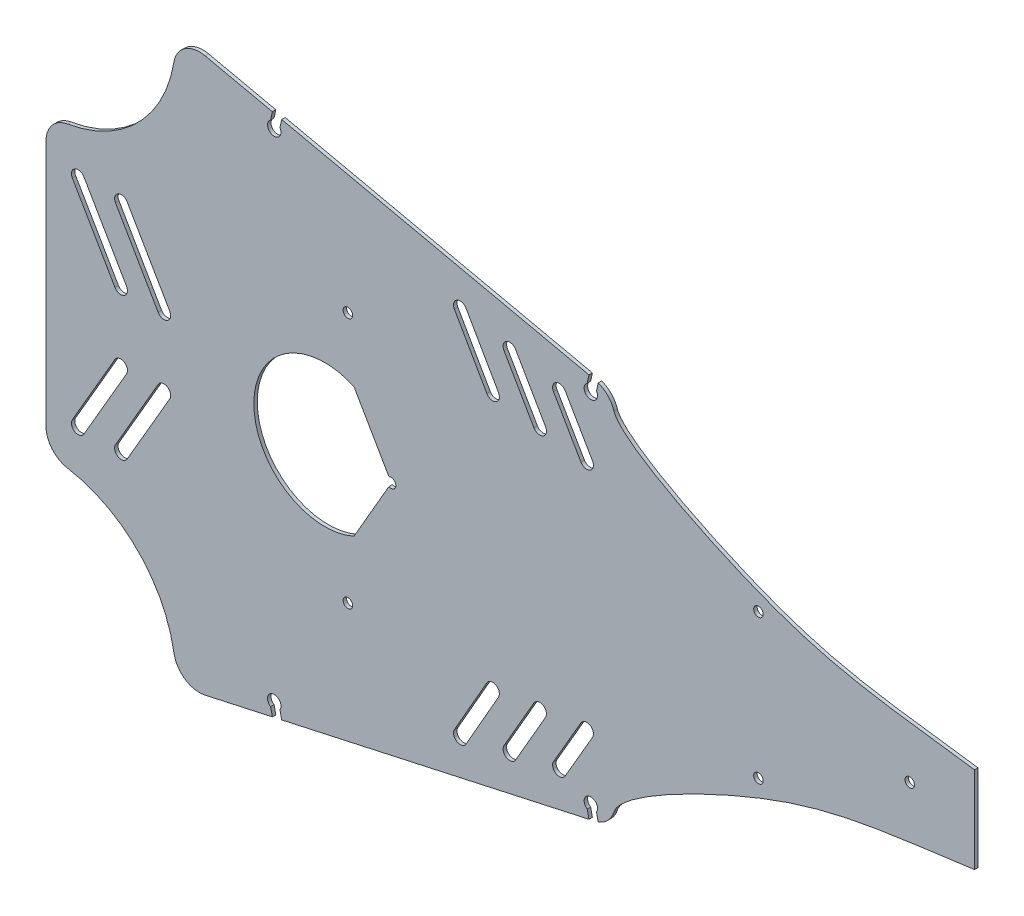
SolidWorks part; units mm, degrees
ref_plane "Plan de face" through (0, 0, 0) normal (0, 0, 1) x (1, 0, 0)
ref_plane "Plan de dessus" through (0, 0, 0) normal (0, 1, 0) x (1, 0, 0)
ref_plane "Plan de droite" through (0, 0, 0) normal (1, 0, 0) x (0, 0, -1)
sketch "Esquisse1" plane through (0, 0, 0) normal (0, 0, 1) x (1, 0, 0)
  line L0 (-5.9651, 0) -> (289.2459, 0) construction
  line L1 (0, 92.9067) -> (0, -65.7395) construction
  line L2 (240, 27.2953) -> (240, -49.3367) construction
  line L3 (235.0104, 10) -> (266.2783, 10) construction
  line L4 (190, 37.2908) -> (190, 8.3296) construction
  line L5 (151.4178, 47.9562) -> (151.4178, 31.9439) construction
  line L6 (156.4178, 47.9562) -> (156.4178, 31.9439) construction
  line L7 (145.1918, 42.3156) -> (161.4566, 42.3156) construction
  line L8 (77.9646, 57.4689) -> (151.4178, 41.3156) construction
  line L9 (50, 78.0416) -> (50, 0) construction
  line L10 (29.7186, 35) -> (59.7051, 35) construction
  line L11 (146.8802, 41.3156) -> (162.0757, 41.3156) construction
  line L12 (11.2531, 0) -> (36.1654, 0) construction
  line L13 (25.1505, 91.0913) -> (25.1505, 10) construction
  line L14 (30, 12.412) -> (30, -14.7132) construction
  line L15 (15.6126, 74) -> (37.7434, 74) construction
  line L16 (25.1505, 28.5698) -> (25.1505, -28.5698)
  line L17 (61.9581, -64.0606) -> (152.1313, -44.2303)
  line L20 (240, 10) -> (240, -10)
  line L22 (40.7677, 68.7207) -> (239.6066, 24.9934) construction
  line L23 (18.2919, 84.0663) -> (34.0867, 84.0663) construction
  line L24 (61.9581, 64.0606) -> (152.1313, 44.2303)
  line L28 (225, 6.545) -> (225, -7.5044) construction
  line L29 (105, 13.9669) -> (105, -11.5576) construction
  line L30 (240, 10) -> (50, 35) construction
  line L31 (95, 40.4284) -> (95, 18.8854) construction
  line L32 (190, 22.4382) -> (190, 10) construction
  line L35 (71.8037, 60) -> (90.5861, 60) construction
  line L37 (15.6126, 64) -> (37.7434, 64) construction
  circle A0 centre (25.1505, 84.0663) radius 45 construction
  arc A1 (0, 88.473) -> (0, 39.6597) centre (25.1505, 64.0663) ccw construction
  circle A2 centre (151.2142, 41.3603) radius 1.55
  arc A3 (61.9581, 64.0606) -> (54.7496, 59.1783) centre (60.6694, 58.2007) ccw
  arc A4 (30.1505, 34.4859) -> (54.7496, 59.1783) centre (25.1505, 64.0663) ccw
  arc A5 (30.1505, 34.4859) -> (25.1505, 28.5698) centre (31.1505, 28.5698) ccw
  arc A6 (152.1313, 44.2303) -> (156.556, 40.2028) centre (150.8426, 38.3704) cw
  arc A7 (69.8682, 79.0332) -> (0, 36.6844) centre (25.1505, 74) ccw construction
  arc A8 (27.0449, 29.0714) -> (60.0557, 60.9256) centre (25.1505, 64.0663) ccw construction
  circle A9 centre (151.2142, -41.3603) radius 1.55
  arc A10 (152.1313, -44.2303) -> (156.556, -40.2028) centre (150.8426, -38.3704) ccw
  arc A11 (30.1505, -34.4859) -> (25.1505, -28.5698) centre (31.1505, -28.5698) cw
  arc A12 (30.1505, -34.4859) -> (54.7496, -59.1783) centre (25.1505, -64.0663) cw
  circle A13 centre (225, 0) radius 1.1
  circle A14 centre (105, 0) radius 1.1
  circle A15 centre (190, 16.6831) radius 1.1
  circle A16 centre (95, 29.0789) radius 1.1
  circle A17 centre (190, -16.6831) radius 1.1
  circle A18 centre (95, -29.0789) radius 1.1
  arc A19 (61.9581, -64.0606) -> (54.7496, -59.1783) centre (60.6694, -58.2007) cw
  circle A20 centre (77.9646, -57.4689) radius 1.55
  circle A22 centre (77.9646, 57.4689) radius 1.55
  spline S0 degree 3 poles (240, 10) (216.274, 13.2295) (198.7842, 14.4819) (158.0149, 35.6539) (156.556, 40.2028) knots 0 0 0 0 0.573688 0.920874 0.920874 0.920874 0.920874
  spline S1 degree 3 poles (240, -10) (216.274, -13.2295) (198.7842, -14.4819) (158.0149, -35.6539) (156.556, -40.2028) knots 0 0 0 0 0.573688 0.920874 0.920874 0.920874 0.920874
  point P42 (55.1316, 65.1303)
  point P61 (70.1499, 83.8306)
  point P69 (240, 0)
  point P99 (25.1505, 0)
  point P115 (60.1038, 65.8072)
  dimension "D1" = 75
  dimension "D2" = 5
  dimension "D3" = 3
  dimension "D4" = 6
  dimension "D5" = 6
  dimension "D6" = 6
extrude "Extrusion1" add sketch "Esquisse1" along normal blind 0.8
sketch "Esquisse2" plane through (0, 0, 0.8) normal (0, 0, 1) x (1, 0, 0)
  line L0 (-10.1186, 0) -> (255.56, 0) construction
  line L1 (157.7597, -13.9988) -> (133.7052, -55.4498) construction
  line L2 (61.9581, -64.0606) -> (148.5599, -45.0157) construction
  line L3 (191.1, 16.6831) -> (74.3906, 31.7373) construction
  line L4 (61.9581, -64.0606) -> (152.1313, -44.2303) construction
  line L5 (58.6607, -56.5946) -> (155.7443, -35.2446) construction
  line L6 (95, -29.0789) -> (190, -16.6831) construction
  line L7 (177.5769, -23.3465) -> (63.3181, -38.2553) construction
  line L8 (147.7597, -13.9988) -> (123.7052, -55.4498) construction
  line L9 (137.7597, -13.9988) -> (113.7052, -55.4498) construction
  line L10 (60.3867, 22.9206) -> (16.5928, -52.5456) construction
  line L11 (-1.5475, -25) -> (71.8968, -25) construction
  line L12 (138.0538, -27.5543) -> (131.116, -39.5914)
  line L13 (148.9266, -26.1319) -> (142.5811, -37.0666)
  line L14 (140.7396, -29.1023) -> (133.8018, -41.1394)
  line L15 (127.1595, -28.9803) -> (119.6503, -42.117)
  line L16 (151.6079, -27.6879) -> (145.2623, -38.6226)
  line L17 (4.2891, -8) -> (63.3181, -8) construction
  line L18 (129.8509, -30.5187) -> (122.3417, -43.6555)
  line L19 (127.1595, 28.9803) -> (119.6503, 42.117)
  line L20 (105.0672, 0) -> (80.0672, 43.3013) construction
  line L21 (105.0672, 0) -> (96.407, 15)
  line L22 (105.0672, 0) -> (96.407, -15)
  line L23 (35, 0) -> (29.2831, 34.2655) construction
  line L24 (42.5778, -25) -> (52.4431, -8) construction
  line L25 (52.5778, -25) -> (62.4431, -8) construction
  line L26 (33.9184, -25.778) -> (43.7837, -8.778)
  line L27 (50, 0) -> (44.5318, 32.775) construction
  line L28 (43.9184, -25.778) -> (53.7837, -8.778)
  line L29 (53.9184, -25.778) -> (63.7837, -8.778) construction
  line L30 (31.2372, -24.222) -> (41.1025, -7.222)
  line L31 (41.2372, -24.222) -> (51.1025, -7.222)
  line L32 (51.2372, -24.222) -> (61.1025, -7.222) construction
  line L33 (140.7396, 29.1023) -> (133.8018, 41.1394)
  line L34 (138.0538, 27.5543) -> (131.116, 39.5914)
  line L35 (148.9266, 26.1319) -> (142.5811, 37.0666)
  line L36 (151.6079, 27.6879) -> (145.2623, 38.6226)
  line L37 (33.9184, 25.778) -> (43.7837, 8.778)
  line L38 (31.2372, 24.222) -> (41.1025, 7.222)
  line L39 (43.9184, 25.778) -> (53.7837, 8.778)
  line L40 (41.2372, 24.222) -> (51.1025, 7.222)
  line L41 (51.2372, 24.222) -> (61.1025, 7.222) construction
  line L42 (53.9184, 25.778) -> (63.7837, 8.778) construction
  line L43 (129.8509, 30.5187) -> (122.3417, 43.6555)
  arc A0 (148.9266, -26.1319) -> (151.6079, -27.6879) centre (150.2672, -26.9099) cw
  arc A1 (142.5811, -37.0666) -> (145.2623, -38.6226) centre (143.9217, -37.8446) ccw
  arc A2 (131.116, -39.5914) -> (133.8018, -41.1394) centre (132.4589, -40.3654) ccw
  arc A3 (140.7396, -29.1023) -> (138.0538, -27.5543) centre (139.3967, -28.3283) ccw
  arc A4 (129.8509, -30.5187) -> (127.1595, -28.9803) centre (128.5052, -29.7495) ccw
  arc A5 (119.6503, -42.117) -> (122.3417, -43.6555) centre (120.996, -42.8863) ccw
  arc A6 (41.1025, -7.222) -> (43.7837, -8.778) centre (42.4431, -8) cw
  arc A7 (51.1025, -7.222) -> (53.7837, -8.778) centre (52.4431, -8) cw
  arc A8 (61.1025, -7.222) -> (63.7837, -8.778) centre (62.4431, -8) cw construction
  arc A9 (53.9184, -25.778) -> (51.2372, -24.222) centre (52.5778, -25) cw construction
  arc A10 (43.9184, -25.778) -> (41.2372, -24.222) centre (42.5778, -25) cw
  arc A11 (33.9184, -25.778) -> (31.2372, -24.222) centre (32.5778, -25) cw
  arc A12 (119.6503, 42.117) -> (122.3417, 43.6555) centre (120.996, 42.8863) cw
  arc A13 (96.407, 15) -> (96.407, -15) centre (89.6766, 0) ccw
  arc A14 (131.116, 39.5914) -> (133.8018, 41.1394) centre (132.4589, 40.3654) cw
  arc A15 (142.5811, 37.0666) -> (145.2623, 38.6226) centre (143.9217, 37.8446) cw
  arc A16 (148.9266, 26.1319) -> (151.6079, 27.6879) centre (150.2672, 26.9099) ccw
  arc A17 (33.9184, 25.778) -> (31.2372, 24.222) centre (32.5778, 25) ccw
  arc A18 (41.1025, 7.222) -> (43.7837, 8.778) centre (42.4431, 8) ccw
  arc A19 (51.1025, 7.222) -> (53.7837, 8.778) centre (52.4431, 8) ccw
  arc A20 (43.9184, 25.778) -> (41.2372, 24.222) centre (42.5778, 25) ccw
  arc A21 (53.9184, 25.778) -> (51.2372, 24.222) centre (52.5778, 25) ccw construction
  arc A22 (61.1025, 7.222) -> (63.7837, 8.778) centre (62.4431, 8) ccw construction
  arc A23 (129.8509, 30.5187) -> (127.1595, 28.9803) centre (128.5052, 29.7495) cw
  arc A24 (140.7396, 29.1023) -> (138.0538, 27.5543) centre (139.3967, 28.3283) cw
  dimension "D7" = 60
  dimension "D8" = 15
  dimension "D1" = 8
  dimension "D2" = 5
  dimension "D3" = 1.55
  dimension "D4" = 1.55
extrude "Enlèv. mat.-Extru.1" cut sketch "Esquisse2" against normal through all
sketch "Esquisse3" plane through (0, 0, 0.8) normal (0, 0, 1) x (1, 0, 0)
  line L0 (150.1399, 41.5966) -> (152.2886, 41.1241)
  line L1 (69.2496, 62.4571) -> (158.3599, 42.8606) construction
  line L2 (152.1313, 44.2303) -> (61.9581, 64.0606) construction
  line L3 (152.8862, 54.0845) -> (155.0348, 53.612)
  line L4 (79.0389, 57.2327) -> (81.393, 67.9375)
  line L5 (152.2886, 41.1241) -> (155.0348, 53.612)
  line L6 (76.8902, 57.7052) -> (79.2444, 68.41)
  line L7 (150.1399, 41.5966) -> (152.8862, 54.0845)
  line L8 (79.2444, 68.41) -> (81.393, 67.9375)
  line L9 (76.8902, 57.7052) -> (79.0389, 57.2327)
  line L10 (8.5988, 0) -> (233.4394, 0) construction
  line L11 (76.8902, -57.7052) -> (79.0389, -57.2327)
  line L12 (79.2444, -68.41) -> (81.393, -67.9375)
  line L13 (76.8902, -57.7052) -> (79.2444, -68.41)
  line L14 (79.0389, -57.2327) -> (81.393, -67.9375)
  line L15 (150.1399, -41.5966) -> (152.8862, -54.0845)
  line L16 (152.2886, -41.1241) -> (155.0348, -53.612)
  line L17 (152.8862, -54.0845) -> (155.0348, -53.612)
  line L18 (150.1399, -41.5966) -> (152.2886, -41.1241)
extrude "Enlèv. mat.-Extru.2" cut sketch "Esquisse3" against normal through all
